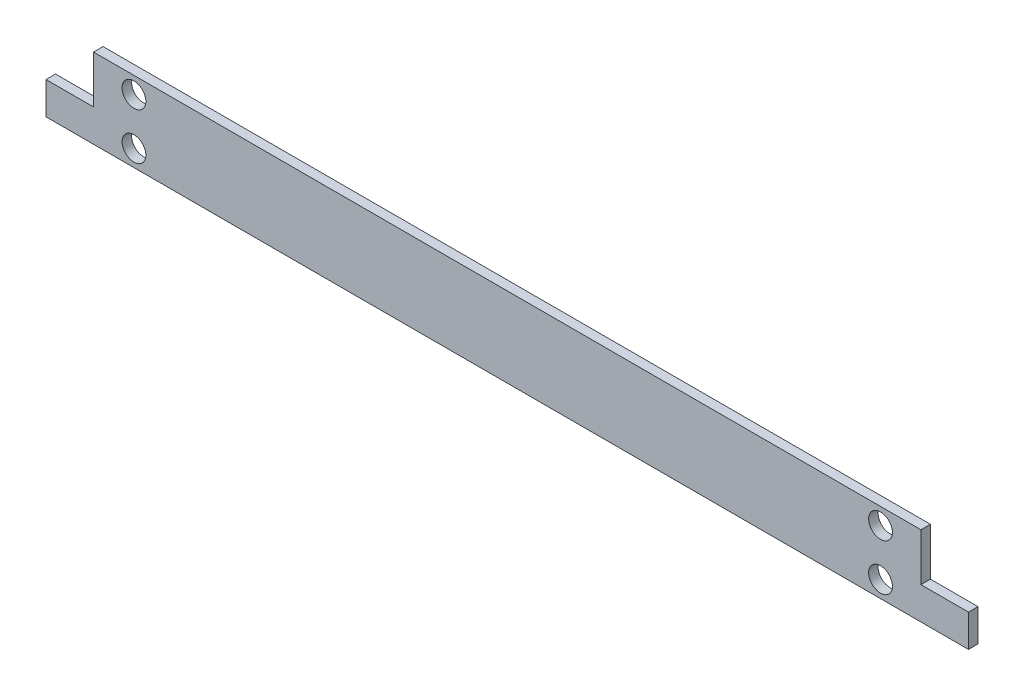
SolidWorks part; units mm, degrees
ref_plane "Front Plane" through (0, 0, 0) normal (0, 0, 1) x (1, 0, 0)
ref_plane "Top Plane" through (0, 0, 0) normal (0, 1, 0) x (1, 0, 0)
ref_plane "Right Plane" through (0, 0, 0) normal (1, 0, 0) x (0, 0, -1)
sketch "Sketch1" plane through (0, 0, 0) normal (0, 0, 1) x (1, 0, 0)
  line L1 (0, 0) -> (246.38, 0)
  line L2 (0, 0) -> (0, 21.336)
  line L3 (0, 21.336) -> (246.38, 21.336)
  line L4 (246.38, 0) -> (246.38, 21.336)
  line L5 (0, 21.336) -> (12.7, 21.336)
  line L6 (0, 21.336) -> (0, 8.636)
  line L7 (0, 8.636) -> (12.7, 8.636)
  line L8 (12.7, 21.336) -> (12.7, 8.636)
  line L9 (246.38, 21.336) -> (233.68, 21.336)
  line L10 (246.38, 21.336) -> (246.38, 8.636)
  line L11 (246.38, 8.636) -> (233.68, 8.636)
  line L12 (233.68, 21.336) -> (233.68, 8.636)
  circle A0 centre (23.495, 4.445) radius 3.175
  circle A1 centre (23.495, 16.891) radius 3.175
  circle A2 centre (222.885, 16.891) radius 3.175
  circle A3 centre (222.885, 4.445) radius 3.175
  dimension "D7" = 6.35
  dimension "D1" = 21.336
  dimension "D2" = 246.38
  dimension "D3" = 4.445
  dimension "D4" = 4.445
  dimension "D5" = 23.495
  dimension "D6" = 23.495
  dimension "D8" = 12.7
  dimension "D9" = 12.7
  dimension "D10" = 12.7
  dimension "D11" = 12.7
extrude "Boss-Extrude1" add sketch "Sketch1" along normal blind 2.54 contours L1 L4 L3 L2 A3 A2 A1 A0
